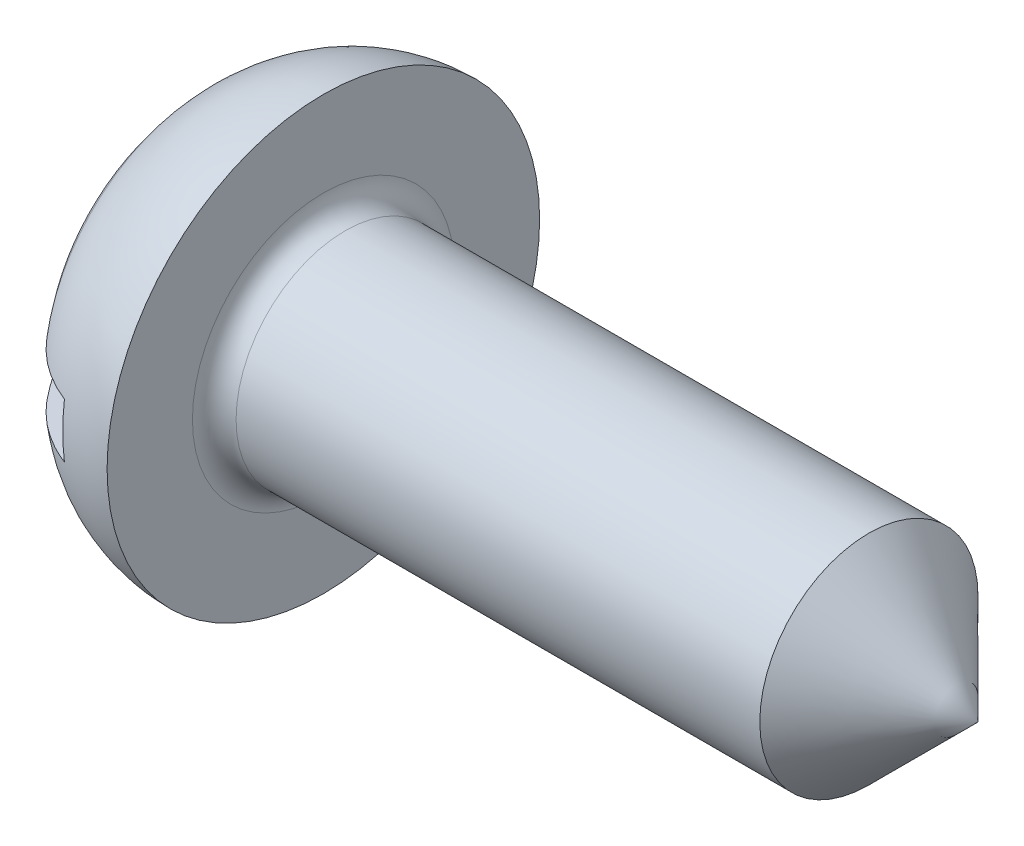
SolidWorks part; units mm, degrees
ref_plane "Front" through (0, 0, 0) normal (0, 0, 1) x (1, 0, 0)
ref_plane "Top" through (0, 0, 0) normal (0, 1, 0) x (1, 0, 0)
ref_plane "Right" through (0, 0, 0) normal (1, 0, 0) x (0, 0, -1)
other "Configuration Table"
sketch "Sketch2" plane through (2.3892, 0, -0.4071) normal (0, 1, 0) x (0, 0, -1)
  line L0 (-0.4071, 0.7892) -> (-0.4071, 1.2892)
  line L2 (-0.4071, 1.2892) -> (-0.1571, 1.2892)
  line L3 (-0.1571, 1.2892) -> (-0.1571, 2.3892)
  line L4 (-0.4071, 0.7892) -> (1.5751, 0.7892)
  line L5 (-0.4071, -1.008) -> (-0.4071, 3.8043) construction
  arc A0 (-0.1571, 2.3892) -> (1.0806, 1.8569) centre (-0.4071, 0.1029) cw
  arc A1 (1.5751, 0.7892) -> (1.0806, 1.8569) centre (0.1751, 0.7892) ccw
  dimension "r1" = 2.3
  dimension "r2" = 1.4
  dimension "t" = 1.1
  dimension "n" = 0.5
  dimension "k" = 1.6
revolve "BaseHead" add sketch "Sketch2" angle 360 about L5
sketch "Sketch1" plane through (1.6, 0.5923, -0.1734) normal (1, 0, 0) x (0, 0, -1)
  circle A0 centre (-0.1734, -0.5923) radius 1
  circle A1 centre (-0.1734, -0.5923) radius 1.9821 construction
extrude "BaseBody" add sketch "Sketch1" along normal blind 6
sketch "Sketch3" plane through (1.1978, 1.1978, 0) normal (0, 0, 1) x (0, 1, 0)
  line L0 (-0.9478, 0.0978) -> (-0.9478, 1.1978) construction
  line L1 (-0.9478, 0.0978) -> (-0.9478, 1.1978)
  line L2 (-1.4478, 1.1978) -> (-1.4478, 0.0978) construction
  line L3 (-1.4478, 1.1978) -> (-1.4478, 0.0978)
  line L4 (-1.1978, 0.0526) -> (-1.1978, 2.3431) construction
  line L5 (-1.4478, 1.1978) -> (-0.9478, 1.1978)
  line L6 (-1.4478, 0.0978) -> (-0.9478, 0.0978)
extrude "Slot" cut sketch "Sketch3" against normal through all and the other way through all
sketch "Sketch4" plane through (23.2633, -6.7367, 0) normal (0, 0, 1) x (0, 1, 0)
  line L0 (6.7367, 17.6285) -> (6.7367, 14.19) construction
  line L1 (7.7367, 15.6633) -> (7.7367, 21.6633) construction
  line L3 (8.7367, 14.6633) -> (8.7367, 17.6633)
  line L4 (8.7367, 17.6633) -> (6.7367, 15.6633)
  line L5 (6.7367, 15.6633) -> (6.7367, 14.6633)
  line L6 (6.7367, 14.6633) -> (8.7367, 14.6633)
  line L7 (5.7367, 15.6633) -> (7.7367, 15.6633) construction
  dimension "D1" = 1
  dimension "D2" = 45
  dimension "D3" = 1
revolve "Cut-Revolve1" cut sketch "Sketch4" angle 360 about L0
fillet "Fillet1" radius 0.2 1 edges at (1.6, 0, -1)
sketch "Sketch5" plane through (0, 0, 0) normal (0, 0, 1) x (1, 0, 0)
  line L0 (3.6, 1.2) -> (3.85, 1.2)
  line L1 (3.85, 1.2) -> (3.85, 1)
  line L2 (3.85, 1) -> (3.725, 0.7835)
  line L3 (3.6, 1) -> (3.725, 0.7835)
  line L4 (3.6, 1.2) -> (3.6, 1)
  line L5 (21.5487, 0) -> (0, 0) construction
  line L6 (3.6, 1) -> (3.85, 1) construction
  line L7 (3.725, 1) -> (3.725, 0.7835) construction
  line L8 (6.6, 1) -> (1.8, 1) construction
  point P6 (3.725, 1.2)
revolve "Cut-Revolve10" [suppressed] cut sketch "Sketch5" angle 360 about L5
pattern_linear "LPattern10" [suppressed] count 8 spacing 0.5
equation "\"D3@Sketch5\" = \"D1@ThreadCosmetic1\" + \"d@Sketch1\" / 2"
equation "\"D2@Sketch5\" = (  \"d@Sketch1\" - \"D2@ThreadCosmetic1\" )  / 2"
equation "\"D3@LPattern10\" = \"D2@Sketch5\" * 2"
equation "\"D1@LPattern10\" = \"D3@Sketch5\" / \"D3@LPattern10\""
